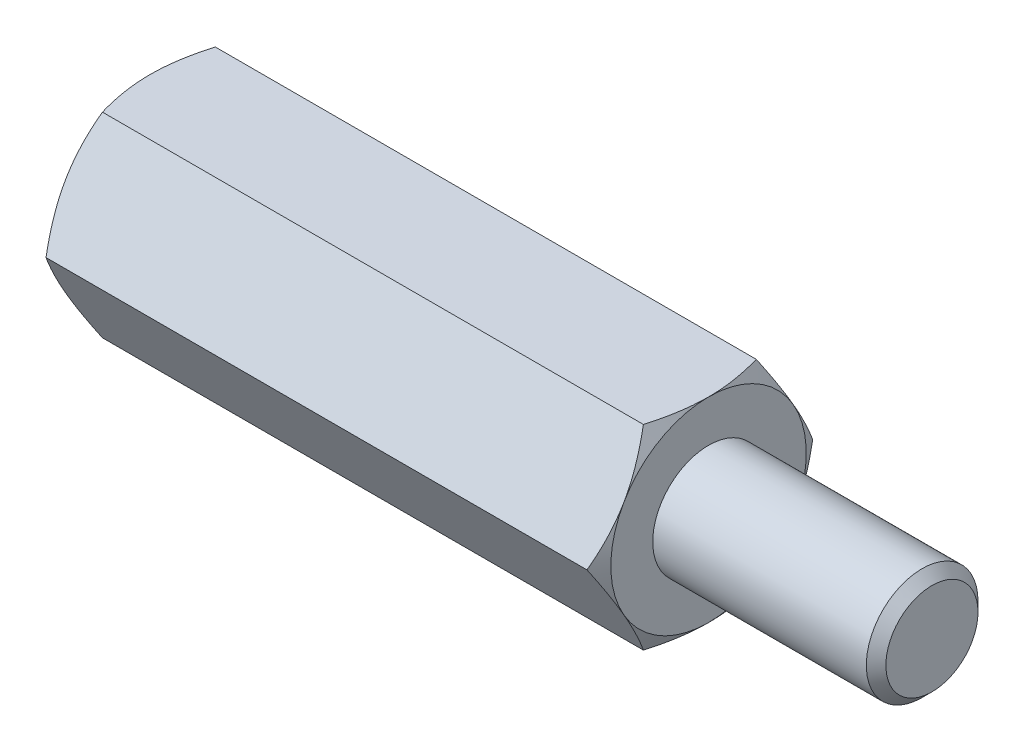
SolidWorks part; units mm, degrees
ref_plane "Front Plane" through (0, 0, 0) normal (0, 0, 1) x (1, 0, 0)
ref_plane "Top Plane" through (0, 0, 0) normal (0, 1, 0) x (1, 0, 0)
ref_plane "Right Plane" through (0, 0, 0) normal (1, 0, 0) x (0, 0, -1)
sketch "Sketch1" plane through (0, 0, 0) normal (1, 0, 0) x (0, 0, -1)
  line L1 (2.0207, 3.5) -> (-2.0207, 3.5)
  line L2 (-2.0207, 3.5) -> (-4.0415, 0)
  line L3 (-4.0415, 0) -> (-2.0207, -3.5)
  line L4 (-2.0207, -3.5) -> (2.0207, -3.5)
  line L5 (2.0207, -3.5) -> (4.0415, 0)
  line L6 (4.0415, 0) -> (2.0207, 3.5)
  circle A0 centre (0, 0) radius 3.5 construction
  dimension "D1" = 7
extrude "Extrude2" add sketch "Sketch1" along normal mid plane 20
sketch "Sketch2" plane through (0, 0, 0) normal (0, 0, 1) x (1, 0, 0)
  line L0 (-10, 3.5) -> (-8.5, 6.0981)
  line L1 (-10, 6.5) -> (-10, 3.5)
  line L3 (0, 0) -> (50000, 0) construction
  arc A0 (-8.5, 6.0981) -> (-10, 6.5) centre (-9.1962, 6.5) ccw
  dimension "D1" = 30
  dimension "D2" = 3
revolve "Cut-Revolve1" cut sketch "Sketch2" angle 360 about L3
mirror "Mirror1" about plane through (0, 0, 0) normal (1, 0, 0) of "Cut-Revolve1"
sketch "Sketch3" plane through (-10, 0, 0) normal (-1, 0, 0) x (0, 0, 1)
  circle A0 centre (0, 0) radius 1.65
  dimension "D1" = 3.3
extrude "Extrude3" cut sketch "Sketch3" against normal blind 8
sketch "Sketch4" plane through (0, 0, 0) normal (0, 0, 1) x (1, 0, 0)
  line L0 (-2, 0) -> (-2, 1.65)
  line L1 (9.6874, 0) -> (-9.6874, 0) construction
  line L2 (-2, 1.65) -> (-1.0474, 0)
  line L3 (-1.0474, 0) -> (-2, 0)
  line L4 (-10, 1.75) -> (-10, -1.75) construction
  point P4 (-10, 0)
  dimension "D1" = 30
  dimension "D2" = 1.65
  dimension "D3" = 8
revolve "Cut-Revolve2" cut sketch "Sketch4" angle 360 about L3
sketch "Sketch5" plane through (10, 0, 0) normal (1, 0, 0) x (0, 0, -1)
  circle A0 centre (0, 0) radius 2
  dimension "D1" = 4
extrude "Extrude4" add sketch "Sketch5" along normal blind 8
chamfer "Chamfer1" distance 0.35 angle 45 1 edges at (18, 0, -2)
equation "\"D2@Sketch4\" = \"D1@Sketch3\"/2"
